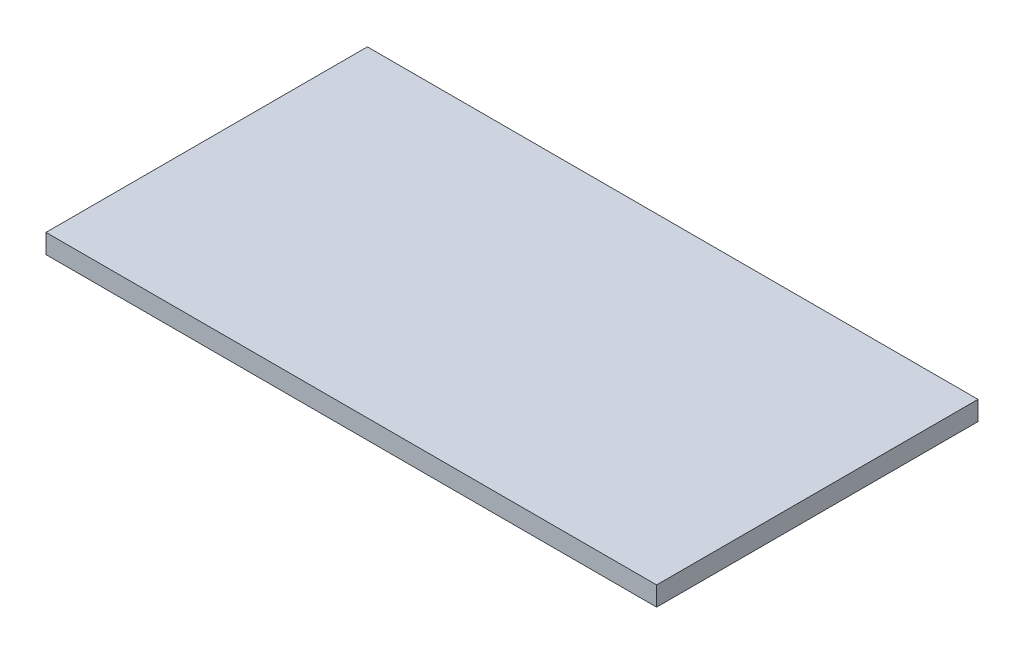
SolidWorks part; units mm, degrees
ref_plane "Plano frontal" through (0, 0, 0) normal (0, 0, 1) x (1, 0, 0)
ref_plane "Plano superior" through (0, 0, 0) normal (0, 1, 0) x (1, 0, 0)
ref_plane "Plano direito" through (0, 0, 0) normal (1, 0, 0) x (0, 0, -1)
sketch "Esboço2" plane through (0, 0, 0) normal (0, 1, 0) x (1, 0, 0)
  line L0 (0, 0) -> (120, 0)
  line L1 (0, 0) -> (0, 100)
  line L2 (120, 0) -> (120, 100)
  line L3 (0, 100) -> (120, 100)
  dimension "D1" = 100
  dimension "D2" = 120
extrude "Ressalto-extrusão1" add sketch "Esboço2" along normal blind 6
sketch "Esboço3" plane through (0, 0, 0) normal (-1, 0, 0) x (0, 0, 1)
  line L1 (-100, 6) -> (0, 6)
  line L2 (-100, 6) -> (-100, 0)
  line L3 (-100, 0) -> (0, 0)
  line L4 (0, 6) -> (0, 0)
extrude "Ressalto-extrusão3" add sketch "Esboço3" along normal blind 70
